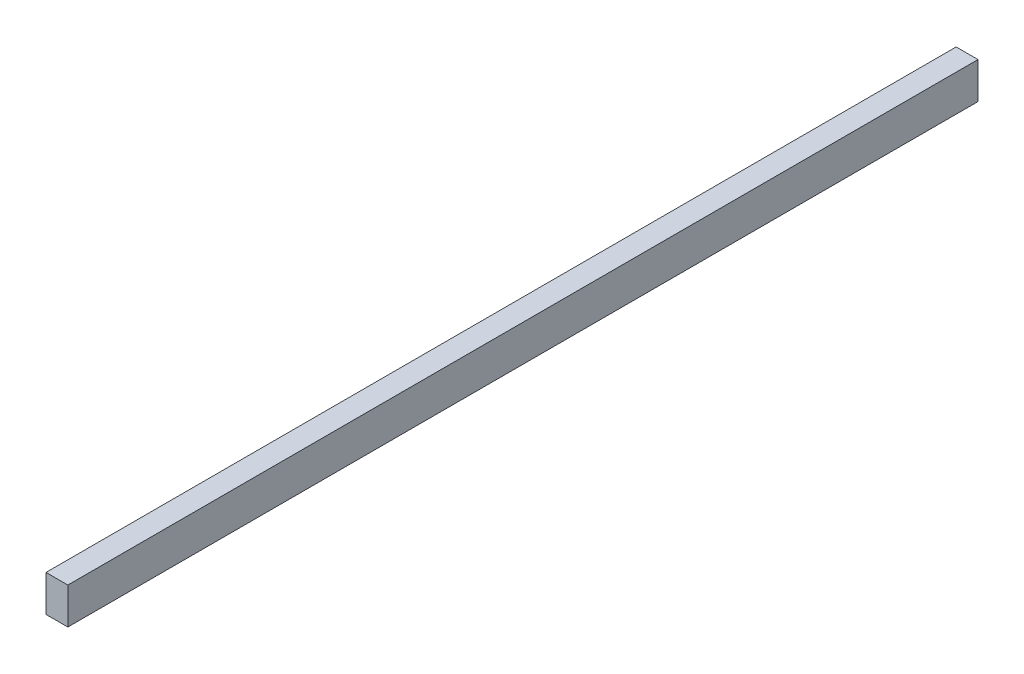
SolidWorks part; units mm, degrees
ref_plane "Face" through (0, 0, 0) normal (0, 0, 1) x (1, 0, 0)
ref_plane "Dessus" through (0, 0, 0) normal (0, 1, 0) x (1, 0, 0)
ref_plane "Droite" through (0, 0, 0) normal (1, 0, 0) x (0, 0, -1)
sketch "Esquisse1" plane through (0, 0, 0) normal (0, 0, 1) x (1, 0, 0)
  line L1 (0, 0) -> (15, 0)
  line L2 (0, 0) -> (0, 25)
  line L3 (0, 25) -> (15, 25)
  line L4 (15, 0) -> (15, 25)
  dimension "D1" = 15
  dimension "D2" = 25
extrude "Extrusion1" add sketch "Esquisse1" along normal blind 625
